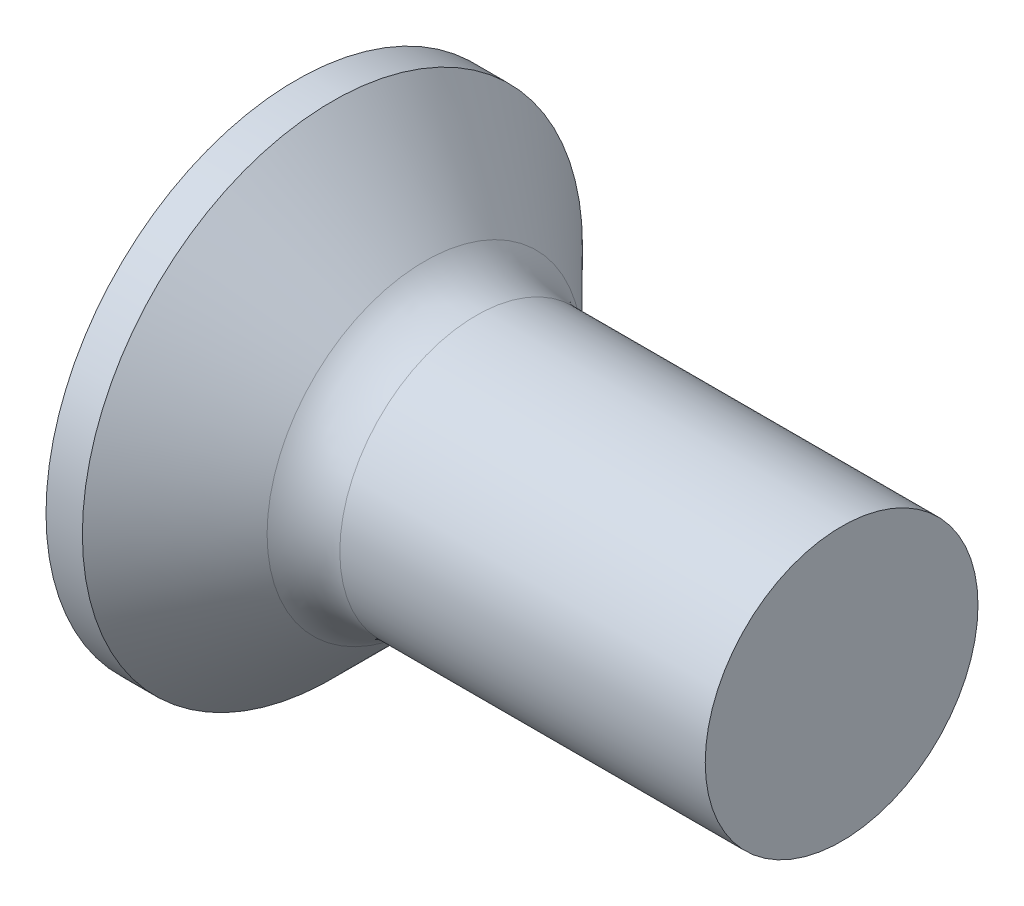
SolidWorks part; units mm, degrees
ref_plane "Plane1" through (0, 0, 0) normal (0, 0, 1) x (1, 0, 0)
ref_plane "Plane2" through (0, 0, 0) normal (0, 1, 0) x (1, 0, 0)
ref_plane "Plane3" through (0, 0, 0) normal (1, 0, 0) x (0, 0, -1)
revolve "Base-Revolve" add sketch "BodySke"
sketch "BodySke" plane through (0, 0, 0) normal (0, 0, 1) x (1, 0, 0)
  line L0 (0, 0) -> (0, 2.75)
  line L1 (0, 2.75) -> (0.4, 2.75)
  line L2 (1.65, 1.5) -> (6, 1.5)
  line L3 (6, 1.5) -> (6, 0)
  line L4 (6, 0) -> (0, 0)
  line L5 (-6.35, 0) -> (82.55, 0) construction
  line L6 (1.65, -1.5) -> (6, -1.5) construction
  line L7 (0.4, -2.75) -> (1.65, -1.5) construction
  line L8 (0.4, 2.75) -> (1.65, 1.5)
  line L9 (0, -2.75) -> (0.4, -2.75) construction
  line L10 (2.15, 3.0875) -> (2.15, -6.4375) construction
  line L11 (0, 6.35) -> (0, -3.175) construction
  dimension "Diameter" = 3
  dimension "Length" = 6
  dimension "Head_ht" = 1.65
  dimension "Head_dia" = 5.5
  dimension "Head_ang" = 90
  dimension "D6" = 0.4
  dimension "Advance" = 0.5
  dimension "Thread_nom" = 6
fillet "Fillet1" radius 0.8 1 edges at (1.65, 0, 1.5)
sketch "Sketch3" plane through (0, 0, 0) normal (-1, 0, 0) x (0, 0, 1)
  line L0 (-0.37, 1.5) -> (0.37, 1.5)
  line L1 (0.37, 1.5) -> (0.37, -1.5)
  line L2 (0.37, -1.5) -> (-0.37, -1.5)
  line L3 (-0.37, -1.5) -> (-0.37, 1.5)
  dimension "D1" = 1.5
  dimension "Cross_dia" = 3
  dimension "D2" = 0.37
  dimension "Cross_width" = 0.74
ref_plane "Plane4" through (2.01, 0, 0) normal (-1, 0, 0) x (0, 0, 1)
sketch "Sketch4" plane through (2.01, 0, 0) normal (-1, 0, 0) x (0, 0, 1)
  line L0 (-0.37, 0.4979) -> (0.37, 0.4979)
  line L3 (0.37, 0.4979) -> (0.37, -0.4979)
  line L4 (0.37, -0.4979) -> (-0.37, -0.4979)
  line L5 (-0.37, -0.4979) -> (-0.37, 0.4979)
  dimension "D1" = 0.74
  dimension "D2" = 0.9957
  dimension "D3" = 0.37
  dimension "D4" = 0.4979
loft "Recess" cut profiles "Sketch3", "Sketch4"
pattern_circular "RecPat" count 2 every 90 about axis through (0, 0, 0) along (1, 0, 0) of "Recess"
sketch "RecCorSke" plane through (0, 0, 0) normal (0, 0, 1) x (1, 0, 0)
  line L0 (-3.175, 0) -> (15.875, 0) construction
  line L2 (0, 0) -> (0, 0.6966)
  line L3 (0, 0.6966) -> (2.01, 0.556)
  line L4 (2.01, 0.556) -> (2.1907, 0)
  line L5 (2.1907, 0) -> (0, 0)
  dimension "Diameter" = 1.112
  dimension "Depth" = 2.01
  dimension "Draft_angle" = 4
  dimension "Bottom_angle" = 18
revolve "RecessCore" cut sketch "RecCorSke" angle 360 about L0
sketch "ThdSchSke" plane through (0, 0, 0) normal (0, 0, 1) x (1, 0, 0)
  line L0 (2.15, -1.2195) -> (1.9536, -1.5)
  line L1 (2.15, -1.2195) -> (2.3464, -1.5)
  line L2 (2.3464, -1.5) -> (2.3464, -1.875)
  line L3 (-3.175, 0) -> (5.1513, 0) construction
  line L5 (2.3464, -1.875) -> (1.9536, -1.875)
  line L6 (1.9536, -1.875) -> (1.9536, -1.5)
  line L7 (0, 2.75) -> (0, -2.75) construction
  dimension "Thread_minor" = 2.439
  dimension "Diameter" = 3
  dimension "Start" = 2.15
  dimension "SideAngle" = 55
  dimension "VeeAngle" = 70
  dimension "Overcut" = 3.75
revolve "ThreadSchematic" [suppressed] cut sketch "ThdSchSke" angle 360 about L3
pattern_linear "ThdSchPat" [suppressed]
equation "\"D1@Sketch3\" = \"Cross_dia@Sketch3\" / 2"
equation "\"D2@Sketch3\" = \"Cross_width@Sketch3\" / 2"
equation "\"Depth@RecCorSke\" = \"Cross_depth@Plane4\""
equation "\"D1@Sketch4\" = \"Cross_width@Sketch3\""
equation "\"D2@Sketch4\" = \"Cross_dia@Sketch3\" - 2.0 * \"Cross_depth@Plane4\" * tan(26.5  * 0.017453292)"
equation "\"D3@Sketch4\" = \"D1@Sketch4\" / 2"
equation "\"D4@Sketch4\" = \"D2@Sketch4\" / 2"
equation "\"Thread_length@ThreadCosmetic\" = ((sgn( (\"Length@BodySke\" - \"Advance@BodySke\" * 1.0 - \"Head_ht@BodySke\" ) - \"Thread_nom@BodySke\" )-1)*( (\"Length@BodySke\" - \"Advance@BodySke\" * 1.0 - \"Head_ht@BodySke\" "
equation "\"Thread_minor@ThdSchSke\" = \"Thread_minor@ThreadCosmetic\""
equation "\"Diameter@ThdSchSke\" = \"Diameter@BodySke\""
equation "\"Overcut@ThdSchSke\" = \"Diameter@BodySke\" * 1.25"
equation "\"Start@ThdSchSke\" = 0.000001 + \"Length@BodySke\" - \"Thread_length@ThreadCosmetic\"  '---Countersunk---"
equation "\"Num_threads@ThdSchPat\" = int( \"Thread_length@ThreadCosmetic\" / \"Advance@BodySke\" + 0.999 )  + 1"
equation "\"Advance@ThdSchPat\" = \"Thread_length@ThreadCosmetic\" /  (\"Num_threads@ThdSchPat\" - 1) 'relax it"
